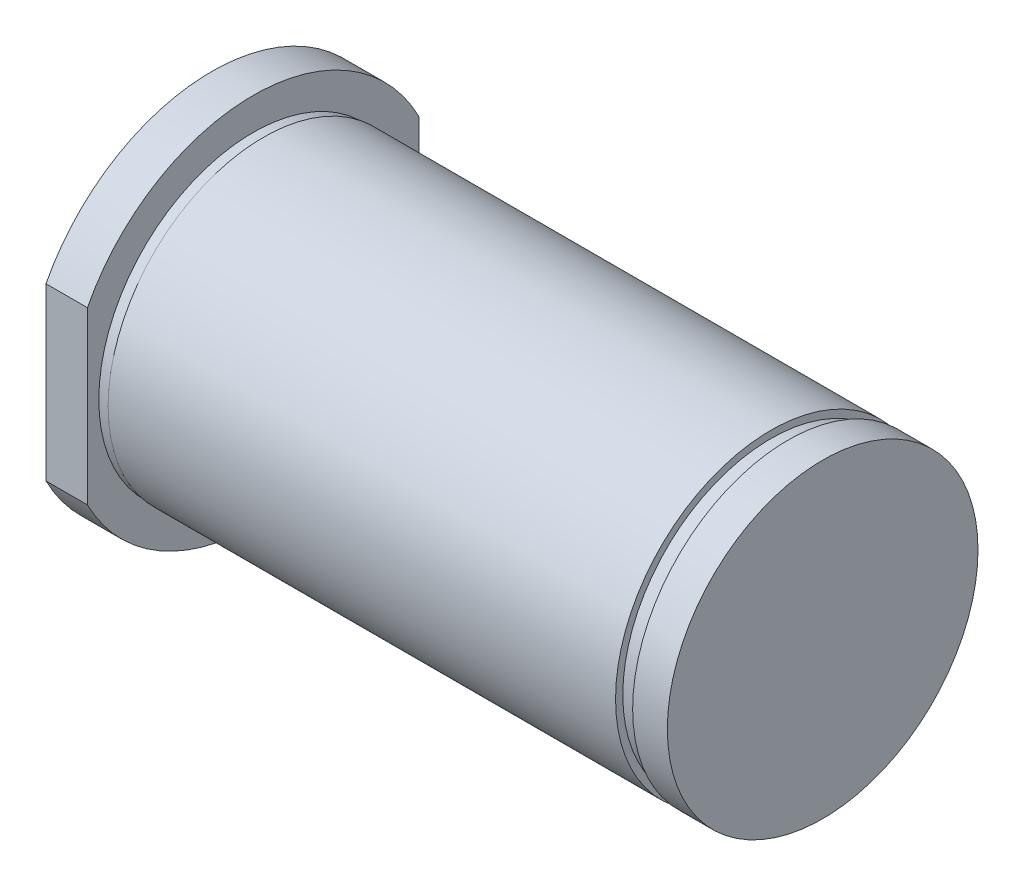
SolidWorks part; units mm, degrees
ref_plane "Front X-Y" through (0, 0, 0) normal (0, 0, 1) x (1, 0, 0)
ref_plane "Top X-Z" through (0, 0, 0) normal (0, 1, 0) x (1, 0, 0)
ref_plane "Right Y-Z" through (0, 0, 0) normal (1, 0, 0) x (0, 0, -1)
ref_plane "Plane1" through (0, 0, 0) normal (0, 0, 1) x (1, 0, 0)
sketch "Sketch1" plane through (0, 0, 0) normal (0, 0, 1) x (1, 0, 0)
  line L0 (0, 0) -> (0, 18)
  line L1 (0, 18) -> (4, 18)
  line L2 (4, 18) -> (4, 14.9)
  line L3 (4, 14.9) -> (5, 14.9)
  line L4 (5, 14.9) -> (5, 15)
  line L5 (5, 15) -> (54, 15)
  line L6 (54, 15) -> (54, 14.3)
  line L7 (54, 14.3) -> (55.65, 14.3)
  line L8 (55.65, 14.3) -> (55.65, 15)
  line L9 (55.65, 15) -> (59, 15)
  line L10 (59, 15) -> (59, 0)
  line L11 (59, 0) -> (0, 0)
  line L12 (59, 0) -> (0, 0) construction
revolve "Revolve1" add sketch "Sketch1" angle 360 about L12
ref_plane "Plane2" through (0, 0, 0) normal (0, 0, 1) x (1, 0, 0)
sketch "Sketch2" plane through (0, 0, 0) normal (0, 0, 1) x (1, 0, 0)
  line L0 (0, 0) -> (0, 8)
  line L1 (0, 8) -> (1.0825, 6.9175)
  line L2 (1.0825, 6.9175) -> (31, 6.9175)
  line L3 (31, 6.9175) -> (34.9938, 0)
  line L4 (34.9938, 0) -> (0, 0)
  line L5 (34.9938, 0) -> (0, 0) construction
revolve "Cut-Revolve1" cut sketch "Sketch2" angle 360 about L5
ref_plane "Plane3" through (0, 0, 0) normal (1, 0, 0) x (0, 0, -1)
sketch "Sketch3" plane through (0, 0, 0) normal (1, 0, 0) x (0, 0, -1)
  line L0 (-21, 41) -> (-21, -41)
  line L1 (-21, -41) -> (21, -41)
  line L2 (21, -41) -> (21, 41)
  line L3 (21, 41) -> (-21, 41)
  line L4 (-16, 36) -> (-16, -36)
  line L5 (-16, -36) -> (16, -36)
  line L6 (16, -36) -> (16, 36)
  line L7 (16, 36) -> (-16, 36)
extrude "Cut-Extrude1" cut sketch "Sketch3" along normal blind 4
